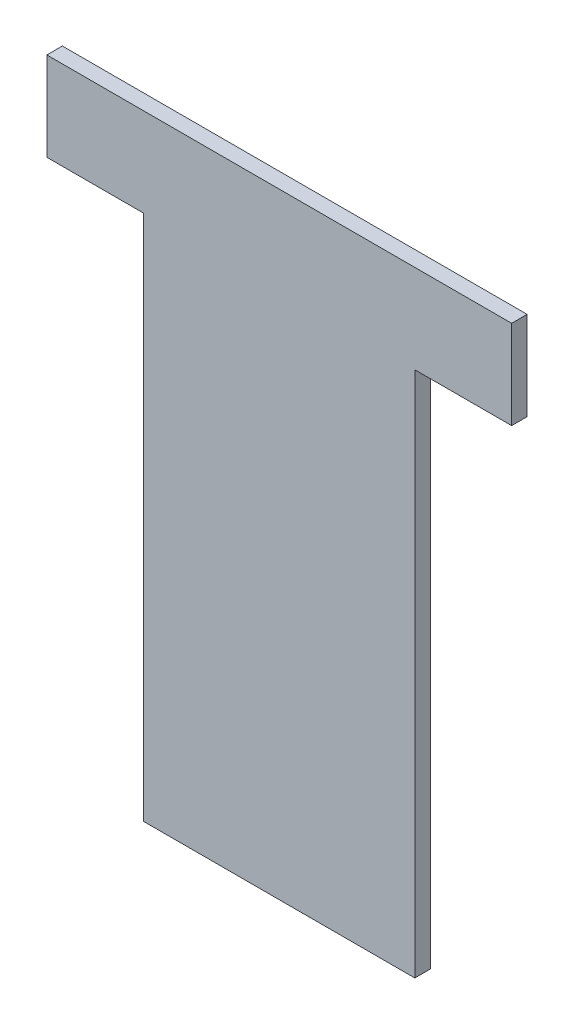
SolidWorks part; units mm, degrees
ref_plane "Alzado" through (0, 0, 0) normal (0, 0, 1) x (1, 0, 0)
ref_plane "Planta" through (0, 0, 0) normal (0, 1, 0) x (1, 0, 0)
ref_plane "Vista lateral" through (0, 0, 0) normal (1, 0, 0) x (0, 0, -1)
sketch "Croquis1" plane through (0, 0, 0) normal (0, 0, 1) x (1, 0, 0)
  line L0 (-124.1487, 115.0461) -> (25.8513, 115.0461)
  line L1 (25.8513, 115.0461) -> (25.8513, 86.4367)
  line L2 (25.8513, 86.4367) -> (-5.3987, 86.4367)
  line L3 (-5.3987, 86.4367) -> (-5.3987, -83.5633)
  line L4 (-5.3987, -83.5633) -> (-92.8987, -83.5633)
  line L5 (-92.8987, -83.5633) -> (-92.8987, 86.4367)
  line L6 (-92.8987, 86.4367) -> (-124.1487, 86.4367)
  line L7 (-124.1487, 86.4367) -> (-124.1487, 115.0461)
  line L8 (-49.1487, -83.5633) -> (-49.1487, 115.0461) construction
  dimension "D1" = 170
  dimension "D2" = 87.5
  dimension "D3" = 150
extrude "Saliente-Extruir1" add sketch "Croquis1" along normal blind 5
